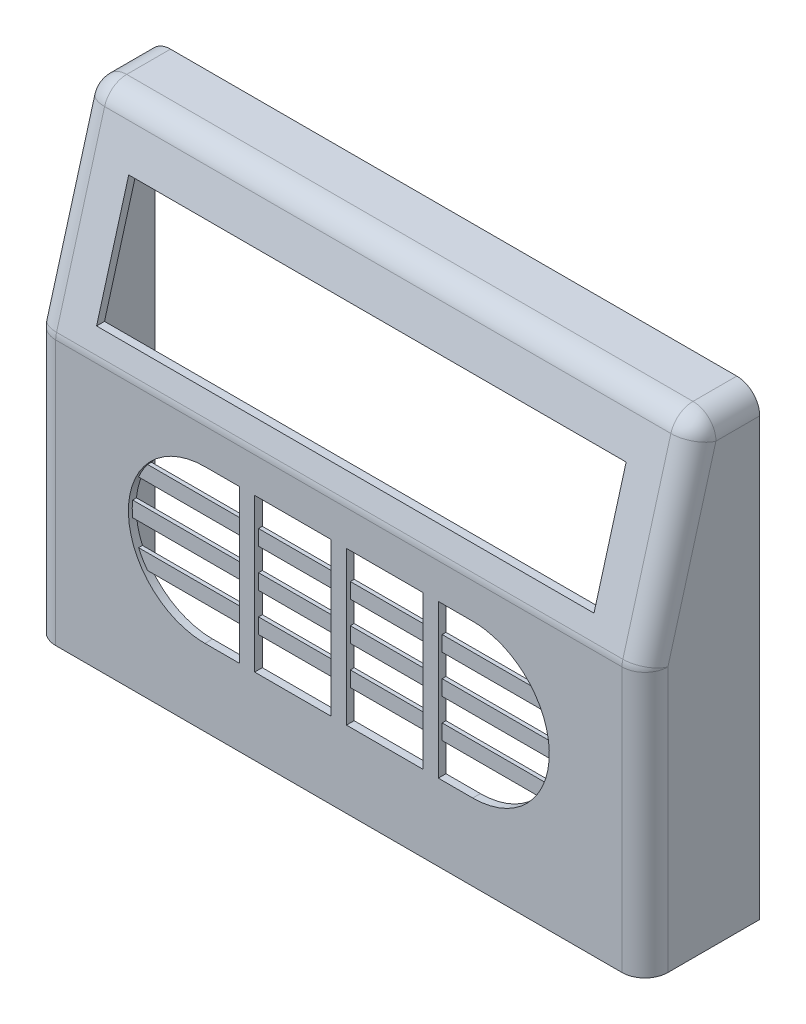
SolidWorks part; units mm, degrees
ref_plane "Front Plane" through (0, 0, 0) normal (0, 0, 1) x (1, 0, 0)
ref_plane "Top Plane" through (0, 0, 0) normal (0, 1, 0) x (1, 0, 0)
ref_plane "Right Plane" through (0, 0, 0) normal (1, 0, 0) x (0, 0, -1)
sketch "Sketch1" plane through (0, 0, 0) normal (1, 0, 0) x (0, 0, -1)
  line L0 (-7.5, 0) -> (7.5, 0)
  line L1 (7.5, 0) -> (7.5, 60)
  line L2 (7.5, 60) -> (-0.5, 60)
  line L3 (-0.5, 60) -> (-7.5, 35)
  line L4 (-7.5, 35) -> (-7.5, 0)
  point P6 (0, 0)
  dimension "D1" = 15
  dimension "D2" = 8
  dimension "D3" = 60
  dimension "D4" = 35
extrude "Boss-Extrude1" add sketch "Sketch1" along normal mid plane 80
fillet "Fillet1" radius 3 8 edges at (-40, 60, -3.5) (40, 60, -3.5) (40, 47.5, 4) (0, 35, 7.5) (0, 60, 0.5) (-40, 47.5, 4) (-40, 17.5, 7.5) (40, 17.5, 7.5)
shell "Shell1" thickness 1
sketch "Sketch2" plane through (0, 0, 7.5) normal (0, 0, 1) x (1, 0, 0)
  line L0 (-17.5, 20) -> (17.5, 20) construction
  line L1 (-17.5, 30) -> (17.5, 30)
  line L2 (-17.5, 10) -> (17.5, 10)
  line L3 (40, 34.5879) -> (40, 0) construction
  line L4 (37, 0) -> (-37, 0) construction
  line L5 (0, 30) -> (0, 10)
  line L6 (-12, 30) -> (-12, 10)
  line L7 (12, 30) -> (12, 10)
  line L8 (-26.1594, 25.0015) -> (26.1594, 25.0015)
  line L9 (-26.1603, 15) -> (26.1603, 15)
  line L10 (-27.5, 20) -> (27.5, 20)
  arc A0 (-17.5, 30) -> (-17.5, 10) centre (-17.5, 20) ccw
  arc A1 (17.5, 10) -> (17.5, 30) centre (17.5, 20) ccw
  point P2 (0, 20)
  dimension "D1" = 35
  dimension "D2" = 22.5
  dimension "D3" = 20
  dimension "D4" = 10
  dimension "D5" = 12
  dimension "D6" = 12
  dimension "D7" = 5.0015
  dimension "D8" = 5
other "Vent1" parameters "RibsDepth"=1, "RibsWidth"=2, "RibsOffset"=0, "SparsDepth"=0.5, "SparsWidth"=2, "SparsOffset"=0.5, "D7"=1, "D8"=0, "Draft"=1
sketch "Sketch3" plane through (0, 0, 7.5) normal (0, 0, 1) x (1, 0, 0)
  line L0 (-37, 60) -> (37, 60) construction
  line L1 (-32.5, 38) -> (32.5, 38)
  line L2 (-32.5, 38) -> (-32.5, 53)
  line L3 (-32.5, 53) -> (32.5, 53)
  line L4 (32.5, 38) -> (32.5, 53)
  line L5 (40, 57) -> (40, 34.5879) construction
  dimension "D1" = 7
  dimension "D2" = 15
  dimension "D3" = 65
  dimension "D4" = 7.5
other "Vent2" parameters "D1"=1, "D2"=5, "D3"=0, "D4"=1, "D5"=2, "D6"=0, "D7"=1, "D8"=0, "D9"=1
